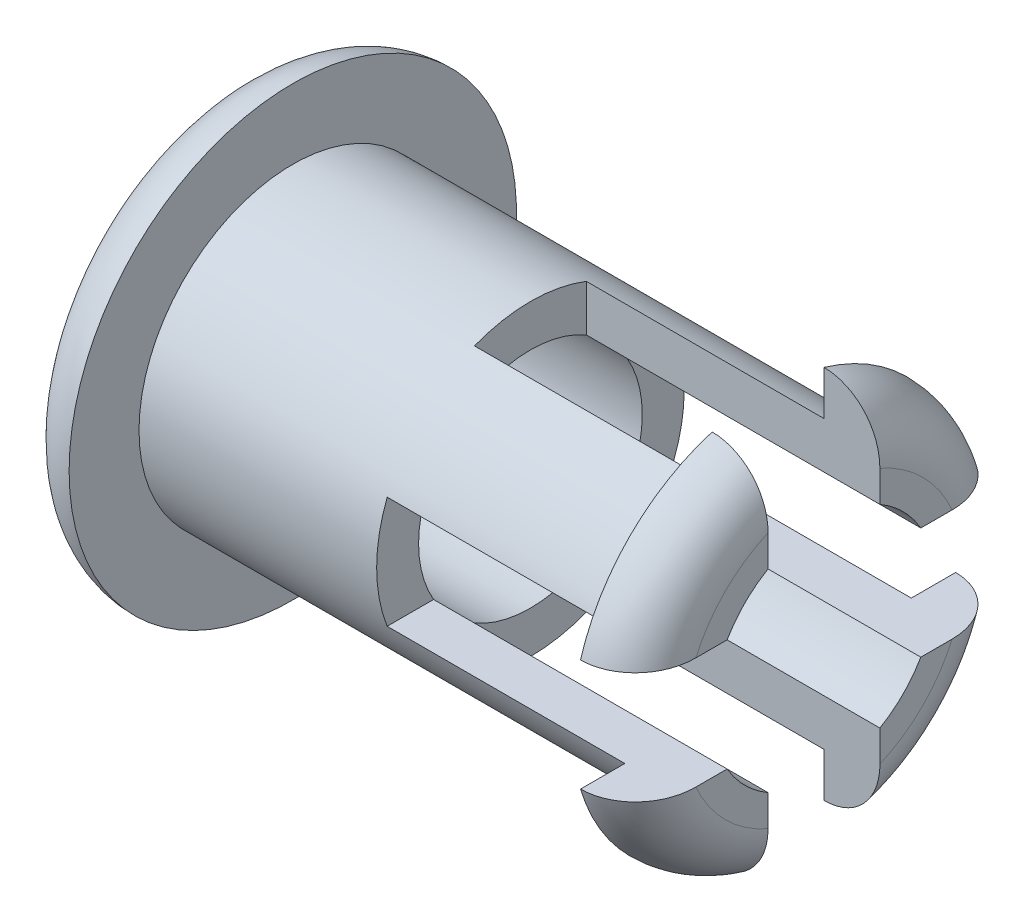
SolidWorks part; units mm, degrees
ref_plane "Front Plane" through (0, 0, 0) normal (0, 0, 1) x (1, 0, 0)
ref_plane "Top Plane" through (0, 0, 0) normal (0, 1, 0) x (1, 0, 0)
ref_plane "Right Plane" through (0, 0, 0) normal (1, 0, 0) x (0, 0, -1)
sketch "Sketch1" plane through (0, 0, 0) normal (1, 0, 0) x (0, 0, -1)
  circle A0 centre (0, 0) radius 8.7312
  dimension "D1" = 17.4625
extrude "Boss-Extrude1" add sketch "Sketch1" along normal mid plane 26.9875
sketch "Sketch2" plane through (-13.4937, 0, 0) normal (-1, 0, 0) x (0, 0, 1)
  circle A0 centre (0, 0) radius 12.7
  dimension "D1" = 25.4
extrude "Boss-Extrude2" add sketch "Sketch2" along normal blind 3.175
sketch "Sketch4" plane through (13.4937, 0, 0) normal (1, 0, 0) x (0, 0, -1)
  circle A0 centre (0, 0) radius 11.1125
  dimension "D1" = 22.225
extrude "Boss-Extrude3" add sketch "Sketch4" along normal blind 3.175
sketch "Sketch3" plane through (-16.6687, 0, 0) normal (-1, 0, 0) x (0, 0, 1)
  circle A0 centre (0, 0) radius 6.35
  dimension "D1" = 12.7
extrude "Cut-Extrude1" cut sketch "Sketch3" against normal through all
sketch "Sketch5" plane through (0, 0, 0) normal (0, 0, 1) x (1, 0, 0)
  line L0 (16.6687, -11.1125) -> (16.6687, 11.1125) construction
  line L1 (0, 3.175) -> (16.6687, 3.175)
  line L2 (0, 3.175) -> (0, -3.175)
  line L3 (0, -3.175) -> (16.6687, -3.175)
  line L4 (16.6687, 3.175) -> (16.6687, -3.175)
  dimension "D1" = 6.35
extrude "Cut-Extrude2" cut sketch "Sketch5" against normal through all both and the other way through all
sketch "Sketch6" plane through (0, 0, 0) normal (0, 1, 0) x (1, 0, 0)
  line L0 (16.6687, -10.6493) -> (16.6687, 10.6493) construction
  line L1 (0, 3.175) -> (16.6687, 3.175)
  line L2 (0, 3.175) -> (0, -3.175)
  line L3 (0, -3.175) -> (16.6687, -3.175)
  line L4 (16.6687, 3.175) -> (16.6687, -3.175)
  dimension "D1" = 6.35
extrude "Cut-Extrude3" cut sketch "Sketch6" against normal through all both and the other way through all
fillet "Fillet1" radius 3.175 5 edges at (-16.6687, 0, 12.7) (16.6687, -7.8577, 7.8577) (16.6687, 7.8577, 7.8577) (16.6687, -7.8577, -7.8577) (16.6687, 7.8577, -7.8577)
